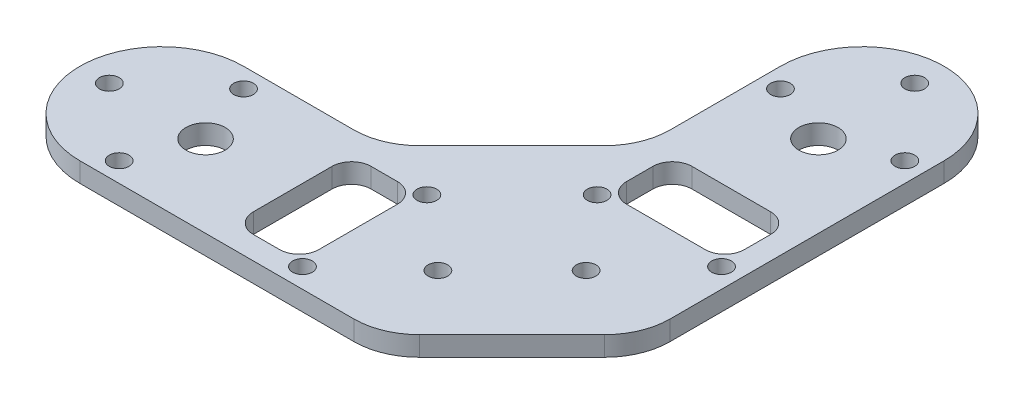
SolidWorks part; units mm, degrees
ref_plane "前视基准面" through (0, 0, 0) normal (0, 0, 1) x (1, 0, 0)
ref_plane "上视基准面" through (0, 0, 0) normal (0, 1, 0) x (1, 0, 0)
ref_plane "右视基准面" through (0, 0, 0) normal (1, 0, 0) x (0, 0, -1)
sketch "草图1" plane through (0, 0, 0) normal (0, 1, 0) x (1, 0, 0)
  line L0 (0, 0) -> (0, 25)
  line L1 (0, 25) -> (41, 25)
  line L2 (41, 25) -> (41, 66)
  line L3 (41, 66) -> (66, 66)
  line L4 (66, 66) -> (66, 0)
  line L5 (66, 0) -> (0, 0)
  dimension "D1" = 66
  dimension "D2" = 25
extrude "凸台-拉伸1" add sketch "草图1" along normal blind 3
chamfer "倒角1" distance 20 angle 45 2 edges at (41, 1.5, -25) (66, 1.5, 0)
fillet "圆角1" radius 10 4 edges at (21, 1.5, -25) (41, 1.5, -45) (66, 1.5, -20) (46, 1.5, 0)
sketch "草图2" plane through (0, 3, 0) normal (0, 1, 0) x (1, 0, 0)
  line L0 (0, 0) -> (41.8579, 0) construction
  line L1 (3, 22) -> (44, 22) construction
  line L2 (3, 22) -> (3, 3) construction
  line L3 (3, 3) -> (63, 3) construction
  line L4 (63, 3) -> (63, 63) construction
  line L5 (16.8579, 25) -> (0, 25) construction
  line L6 (0, 25) -> (0, 0) construction
  line L7 (63, 63) -> (44, 63) construction
  line L8 (44, 63) -> (44, 22) construction
  line L9 (41, 66) -> (41, 49.1421) construction
  line L10 (66, 66) -> (41, 66) construction
  line L11 (66, 24.1421) -> (66, 66) construction
  line L12 (31, 22) -> (31, 3) construction
  line L13 (44, 35) -> (63, 35) construction
  circle A0 centre (3, 22) radius 1.5
  circle A1 centre (3, 3) radius 1.5
  circle A2 centre (31, 3) radius 1.5
  circle A3 centre (31, 22) radius 1.5
  circle A4 centre (44, 35) radius 1.5
  circle A5 centre (63, 35) radius 1.5
  circle A6 centre (63, 63) radius 1.5
  circle A7 centre (44, 63) radius 1.5
  dimension "D9" = 3
  dimension "D1" = 3
  dimension "D2" = 3
  dimension "D3" = 3
  dimension "D4" = 3
  dimension "D5" = 3
  dimension "D6" = 3
  dimension "D7" = 28
  dimension "D8" = 28
extrude "切除-拉伸1" cut sketch "草图2" against normal through all
sketch "草图3" plane through (0, 3, 0) normal (0, 1, 0) x (1, 0, 0)
  line L0 (0, 12.5) -> (25, 12.5) construction
  line L1 (0, 25) -> (0, 0) construction
  line L2 (53.5, 66) -> (53.5, 41) construction
  line L3 (23, 21.5) -> (27, 21.5)
  line L4 (20, 18.5) -> (20, 6.5)
  line L5 (23, 3.5) -> (27, 3.5)
  line L6 (30, 18.5) -> (30, 6.5)
  line L7 (20, 21.5) -> (30, 3.5) construction
  line L8 (20, 3.5) -> (30, 21.5) construction
  line L9 (66, 66) -> (41, 66) construction
  line L11 (47.5, 46) -> (59.5, 46)
  line L12 (44.5, 43) -> (44.5, 39)
  line L13 (47.5, 36) -> (59.5, 36)
  line L14 (62.5, 43) -> (62.5, 39)
  line L15 (44.5, 46) -> (62.5, 36) construction
  line L16 (44.5, 36) -> (62.5, 46) construction
  circle A0 centre (6.7, 12.5) radius 3
  arc A1 (20, 6.5) -> (23, 3.5) centre (23, 6.5) ccw
  arc A2 (27, 3.5) -> (30, 6.5) centre (27, 6.5) ccw
  arc A3 (23, 21.5) -> (20, 18.5) centre (23, 18.5) ccw
  arc A4 (27, 21.5) -> (30, 18.5) centre (27, 18.5) cw
  circle A5 centre (53.5, 59.3) radius 3
  arc A6 (47.5, 46) -> (44.5, 43) centre (47.5, 43) ccw
  arc A7 (59.5, 46) -> (62.5, 43) centre (59.5, 43) cw
  arc A8 (59.5, 36) -> (62.5, 39) centre (59.5, 39) ccw
  arc A9 (44.5, 39) -> (47.5, 36) centre (47.5, 39) ccw
  dimension "D1" = 6.7
  dimension "D2" = 6
  dimension "D6" = 3
  dimension "D10" = 6
  dimension "D11" = 6.7
  dimension "D12" = 3
  dimension "D3" = 10
  dimension "D4" = 18
  dimension "D5" = 25
  dimension "D7" = 25
  dimension "D8" = 10
  dimension "D9" = 18
extrude "切除-拉伸2" cut sketch "草图3" against normal through all
sketch "草图4" plane through (0, 3, 0) normal (0, 1, 0) x (1, 0, 0)
  line L0 (0, 25) -> (0, 0) construction
  line L1 (0, 0) -> (0, 25)
  line L2 (41, 66) -> (66, 66)
  arc A0 (0, 0) -> (0, 25) centre (0, 12.5) cw
  arc A1 (66, 66) -> (41, 66) centre (53.5, 66) ccw
extrude "凸台-拉伸2" add sketch "草图4" against normal through all
sketch "草图5" plane through (0, 3, 0) normal (0, 1, 0) x (1, 0, 0)
  line L0 (53.5, 66) -> (53.5, 78.5) construction
  line L1 (-12.5, 12.5) -> (0, 12.5) construction
  line L2 (56, 10) -> (31, 35) construction
  line L3 (48.9289, 2.9289) -> (63.0711, 17.0711) construction
  line L4 (38.0711, 42.0711) -> (23.9289, 27.9289) construction
  line L5 (41.8579, 12.8284) -> (53.1716, 24.1421) construction
  circle A0 centre (53.5, 74) radius 1.5
  arc A1 (66, 66) -> (41, 66) centre (53.5, 66) ccw construction
  arc A2 (0, 25) -> (0, 0) centre (0, 12.5) ccw construction
  circle A3 centre (-8, 12.5) radius 1.5
  circle A4 centre (53.1716, 24.1421) radius 1.5
  circle A5 centre (41.8579, 12.8284) radius 1.5
  dimension "D1" = 8
  dimension "D2" = 3
  dimension "D3" = 8
  dimension "D4" = 16
  dimension "D5" = 12
extrude "切除-拉伸3" cut sketch "草图5" against normal through all
